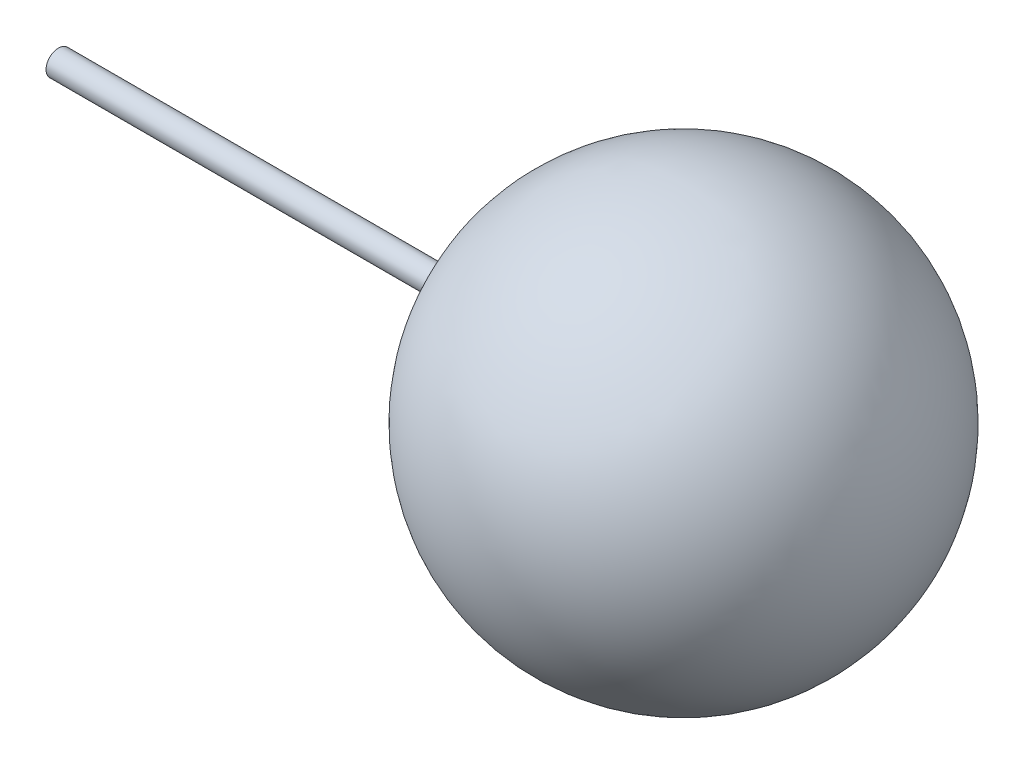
SolidWorks part; units mm, degrees
ref_plane "Ebene vorne" through (0, 0, 0) normal (0, 0, 1) x (1, 0, 0)
ref_plane "Ebene oben" through (0, 0, 0) normal (0, 1, 0) x (1, 0, 0)
ref_plane "Ebene rechts" through (0, 0, 0) normal (1, 0, 0) x (0, 0, -1)
sketch "Skizze1" plane through (0, 0, 0) normal (0, 0, 1) x (1, 0, 0)
  line L0 (-50, 0) -> (50, 0) construction
  line L1 (-50, 0) -> (50, 0)
  line L2 (-50, 0) -> (-150, 0)
  line L3 (-150, 0) -> (-150, 3)
  line L4 (-150, 3) -> (-49.9099, 3)
  arc A0 (50, 0) -> (-49.9099, 3) centre (0, 0) ccw
  dimension "D1" = 100
  dimension "D2" = 3
  dimension "D3" = 100
revolve "Rotation1" add sketch "Skizze1" angle 360 about L0
